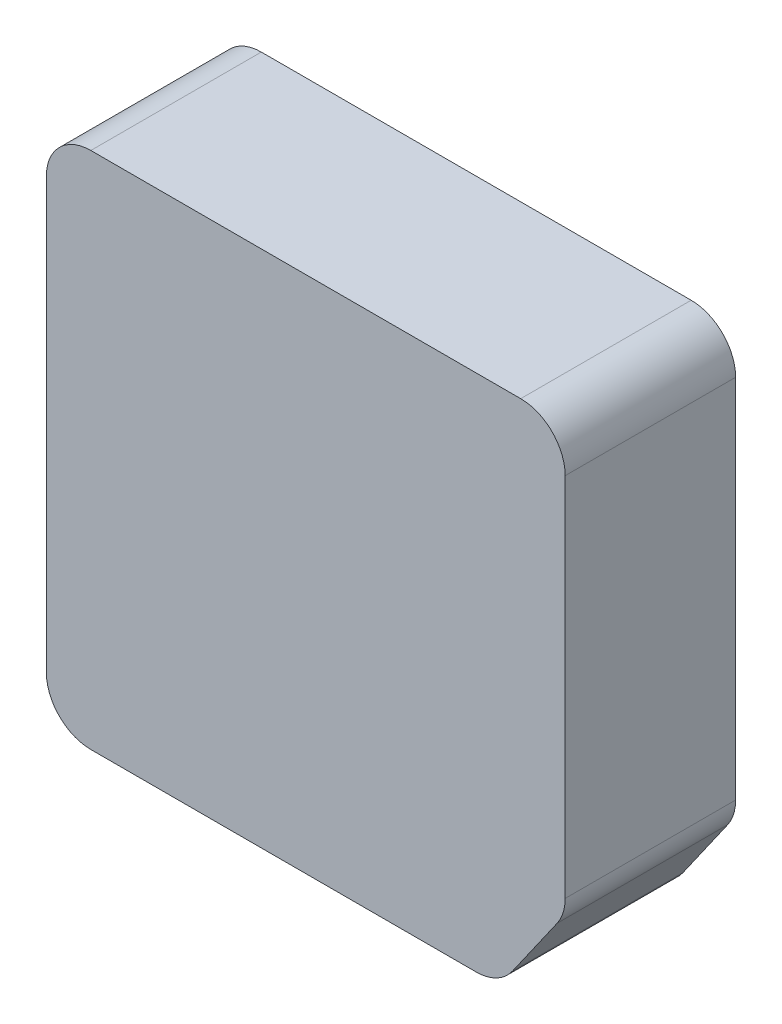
SolidWorks part; units mm, degrees
ref_plane "Front" through (0, 0, 0) normal (0, 0, 1) x (1, 0, 0)
ref_plane "Top" through (0, 0, 0) normal (0, 1, 0) x (1, 0, 0)
ref_plane "Right" through (0, 0, 0) normal (1, 0, 0) x (0, 0, -1)
ref_plane "Plane1"
sketch "Sketch1" plane through (0, 0, 0) normal (0, 0, 1) x (1, 0, 0)
  line L1 (-1027.557, 127.635) -> (-953.897, 127.635)
  line L2 (-1035.177, 120.015) -> (-1035.177, 46.355)
  line L3 (-1027.557, 38.735) -> (-961.5458, 38.735)
  line L4 (-946.277, 120.015) -> (-946.277, 57.2787)
  line L5 (-955.3039, 41.9843) -> (-947.6551, 52.908)
  line L8 (-948.5827, 37.7447) -> (-922.8937, 74.4323) construction
  line L9 (-1028.2966, 83.185) -> (-957.55, 83.185) construction
  line L10 (-990.727, 118.7981) -> (-990.727, 71.1001) construction
  line L11 (-976.122, -85.471) -> (-976.122, 85.471) construction
  line L12 (-976.122, 0) -> (-1015.873, 0) construction
  arc A0 (-947.6551, 52.908) -> (-946.277, 57.2787) centre (-953.897, 57.2787) ccw
  arc A1 (-955.3039, 41.9843) -> (-961.5458, 38.735) centre (-961.5458, 46.355) cw
  arc A2 (-953.897, 127.635) -> (-946.277, 120.015) centre (-953.897, 120.015) cw
  arc A3 (-1035.177, 46.355) -> (-1027.557, 38.735) centre (-1027.557, 46.355) ccw
  arc A4 (-1027.557, 127.635) -> (-1035.177, 120.015) centre (-1027.557, 120.015) ccw
  point P11 (-990.727, 83.185)
  point P20 (-957.5791, 38.735)
extrude "Boss-Extrude1" add sketch "Sketch1" against normal blind 29.21 flip side to cut
